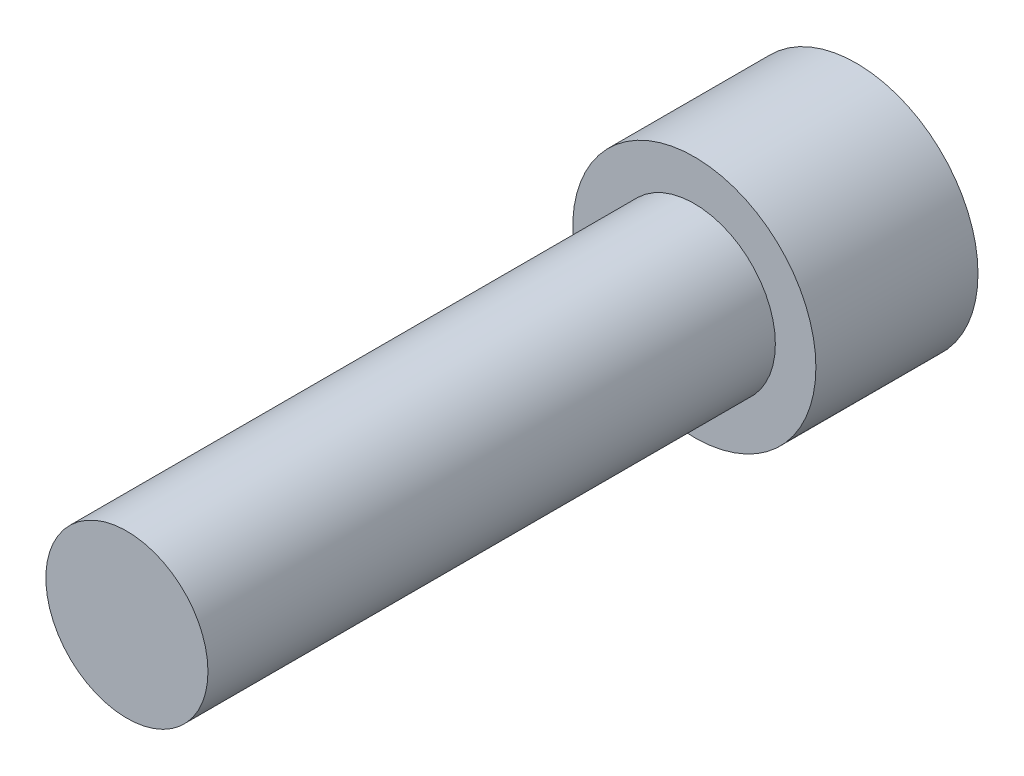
SolidWorks part; units mm, degrees
ref_plane "Front Plane" through (0, 0, 0) normal (0, 0, 1) x (1, 0, 0)
ref_plane "Top Plane" through (0, 0, 0) normal (0, 1, 0) x (1, 0, 0)
ref_plane "Right Plane" through (0, 0, 0) normal (1, 0, 0) x (0, 0, -1)
sketch "Sketch6" plane through (0, 0, 0) normal (1, 0, 0) x (0, 0, -1)
  line L0 (-22.225, 0) -> (22.525, 0) construction
  line L1 (5.2388, 0) -> (-5.2388, 0) construction
  line L2 (-22.225, 0) -> (-22.225, -3.175)
  line L3 (-22.225, -3.175) -> (0, -3.175)
  line L4 (0, 5.2388) -> (0, -5.2388) construction
  line L5 (0, -3.175) -> (0, -4.7625)
  line L6 (0, -4.7625) -> (6.35, -4.7625)
  line L7 (6.35, -4.7625) -> (6.35, 0)
  line L8 (6.35, 0) -> (-22.225, 0)
  dimension "L" = 22.225
  dimension "H" = 6.35
  dimension "A" = 9.525
  dimension "D" = 6.35
revolve "Revolve1" add sketch "Sketch6" angle 360 about L0
sketch "Sketch7" plane through (0, 0, -6.35) normal (0, 0, -1) x (-1, 0, 0)
  line L2 (-2.3876, 1.3785) -> (-2.3876, -1.3785)
  line L4 (-2.3876, -1.3785) -> (0, -2.757)
  line L5 (0, -2.757) -> (2.3876, -1.3785)
  line L6 (2.3876, -1.3785) -> (2.3876, 1.3785)
  line L7 (2.3876, 1.3785) -> (0, 2.757)
  line L8 (0, 2.757) -> (-2.3876, 1.3785)
  circle A0 centre (0, 0) radius 2.3876 construction
  dimension "J" = 4.7752
extrude "HEX" cut sketch "Sketch7" against normal blind 3.556
